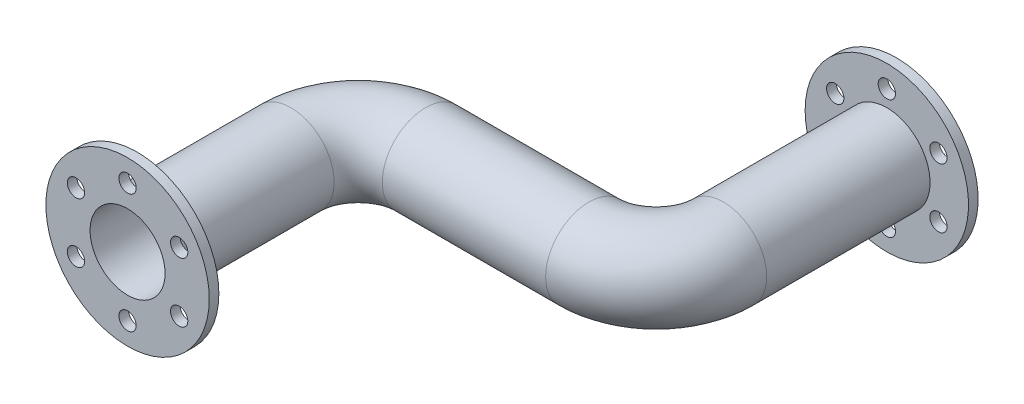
SolidWorks part; units mm, degrees
ref_plane "Front Plane" through (0, 0, 0) normal (0, 0, 1) x (1, 0, 0)
ref_plane "Top Plane" through (0, 0, 0) normal (0, 1, 0) x (1, 0, 0)
ref_plane "Right Plane" through (0, 0, 0) normal (1, 0, 0) x (0, 0, -1)
sketch "Sketch2" plane through (0, 0, 0) normal (0, 1, 0) x (1, 0, 0)
  line L0 (0, 0) -> (0, 85)
  line L1 (35, 120) -> (120, 120)
  line L2 (155, 155) -> (155, 240)
  arc A0 (0, 85) -> (35, 120) centre (35, 85) cw
  arc A1 (120, 120) -> (155, 155) centre (120, 155) ccw
  dimension "D3" = 35
  dimension "D1" = 120
  dimension "D2" = 120
sketch "Sketch3" plane through (0, 0, 0) normal (0, 0, 1) x (1, 0, 0)
  circle A0 centre (0, 0) radius 22.5
  circle A1 centre (0, 0) radius 19.5
  dimension "D1" = 45
  dimension "D2" = 3
sweep "Sweep1" add profiles "Sketch3" path "Sketch2"
sketch "Sketch6" plane through (0, 0, 0) normal (0, 0, 1) x (1, 0, 0)
  circle A0 centre (0, 0) radius 19.5 construction
  circle A1 centre (0, 0) radius 19.5
  circle A5 centre (0, 0) radius 42.5
  dimension "D1" = 85
extrude "Extrude3" add sketch "Sketch6" against normal blind 5
hole_wizard "M10x1.0 Tapped Hole1" positions "Sketch11" profile "Sketch10" tap size "M10x1.0" standard "Ansi Metric"
sketch "Sketch11" plane through (0, 0, 0) normal (0, 0, 1) x (1, 0, 0)
  line L0 (0, -19.5) -> (0, -42.5) construction
  circle A0 centre (0, 0) radius 42.5 construction
  point P9 (0, -31)
sketch "Sketch10" plane through (0, -31, 0) normal (1, 0, 0) x (0, -1, 0)
  line L0 (0, 0) -> (0, 5)
  line L1 (0, 5) -> (4.5, 5)
  line L2 (4.5, 5) -> (4.5, 0)
  line L5 (4.5, 0) -> (0, 0)
  line L11 (0, -6.35) -> (0, 107.95) construction
  dimension "Thru Tap Drill Dia." = 9
  dimension "Thru Tap Drill Depth" = 5
pattern_circular "CirPattern1" count 6 over 360 about axis through (0, 0, 0) along (0, 0, 1) of "M10x1.0 Tapped Hole1"
sketch "Sketch7" plane through (0, 0, -240) normal (0, 0, -1) x (-1, 0, 0)
  circle A0 centre (-155, 0) radius 19.5 construction
  circle A1 centre (-155, 0) radius 19.5
  circle A5 centre (-155, 0) radius 42.5
  dimension "D1" = 85
extrude "Extrude4" add sketch "Sketch7" along normal blind 5
hole_wizard "M10x1.0 Tapped Hole2" positions "Sketch13" profile "Sketch12" tap size "M10x1.0" standard "Ansi Metric"
sketch "Sketch13" plane through (0, 0, -245) normal (0, 0, -1) x (-1, 0, 0)
  line L0 (-155, 19.5) -> (-155, 42.5) construction
  circle A0 centre (-155, 0) radius 19.5 construction
  circle A1 centre (-155, 0) radius 42.5 construction
  point P0 (-155, 31)
sketch "Sketch12" plane through (155, 31, -245) normal (1, 0, 0) x (0, 1, 0)
  line L0 (0, 0) -> (0, 25.7039)
  line L1 (0, 25.7039) -> (4.5, 23)
  line L2 (4.5, 23) -> (4.5, 0)
  line L5 (4.5, 0) -> (0, 0)
  line L10 (0, 25.7039) -> (-4.5, 23) construction
  line L11 (0, -6.35) -> (0, 107.95) construction
  dimension "Tap Drill Dia." = 9
  dimension "Tap Drill Depth" = 23
  dimension "Drill Angle" = 118
pattern_circular "CirPattern2" count 6 over 360 about axis through (155, 0, 0) along (0, 0, 1) of "M10x1.0 Tapped Hole2"
